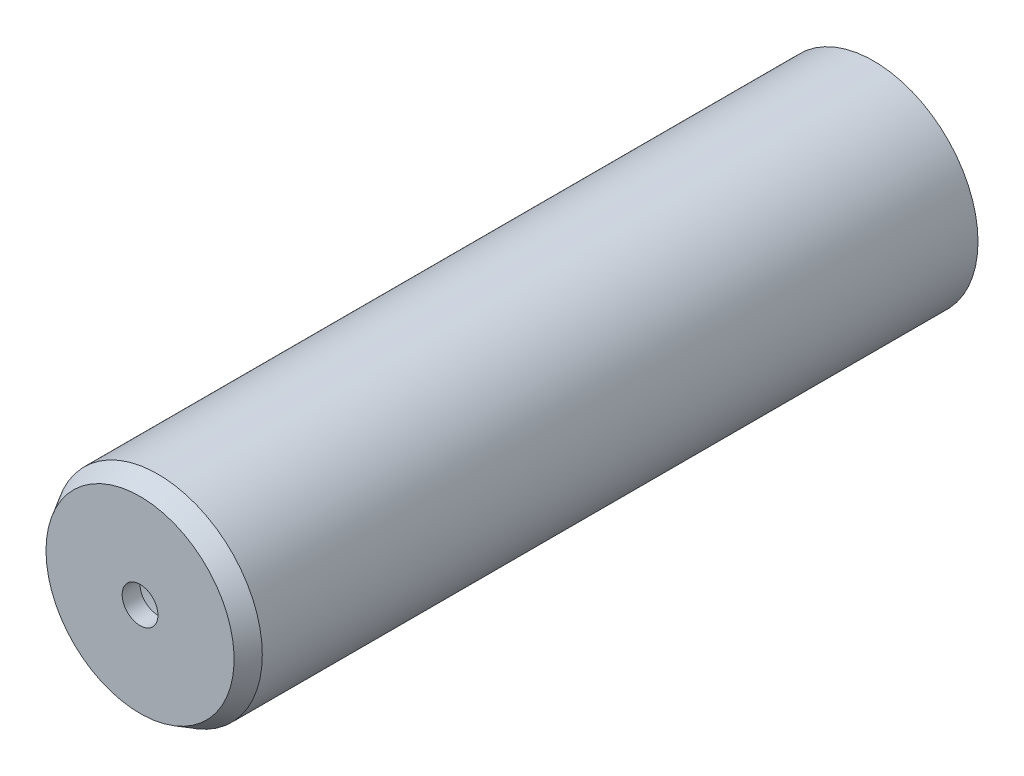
SolidWorks part; units mm, degrees
ref_plane "Спереди" through (0, 0, 0) normal (0, 0, 1) x (1, 0, 0)
ref_plane "Сверху" through (0, 0, 0) normal (0, 1, 0) x (1, 0, 0)
ref_plane "Справа" through (0, 0, 0) normal (1, 0, 0) x (0, 0, -1)
sketch "Эскиз2" plane through (0, 0, 0) normal (0, 0, 1) x (1, 0, 0)
  circle A0 centre (0, 0) radius 17.5
  circle A1 centre (0, 0) radius 15
  dimension "D1" = 35
  dimension "D2" = 30
extrude "Бобышка-Вытянуть1" add sketch "Эскиз2" along normal blind 120
sketch "Эскиз3" plane through (0, 0, 120) normal (0, 0, 1) x (1, 0, 0)
  circle A0 centre (0, 0) radius 17.5
  circle A1 centre (0, 0) radius 3
  dimension "D1" = 6
  dimension "D2" = 35
extrude "Бобышка-Вытянуть2" add sketch "Эскиз3" along normal blind 3
chamfer "Фаска1" distance 3 angle 30 1 edges at (17.5, 0, 123)
sketch "Эскиз5" plane through (0, 0, 0) normal (0, 0, -1) x (-1, 0, 0)
  line L0 (0, 0) -> (0, 15) construction
  line L1 (0, 0) -> (2.985, 14.7) construction
  line L2 (0, 15) -> (0, 10)
  line L3 (0, 10) -> (1.9502, 9.604)
  line L4 (1.9502, 9.604) -> (2.985, 14.7)
  circle A0 centre (0, 0) radius 15 construction
  arc A1 (0, 15) -> (2.985, 14.7) centre (0, 0) cw
  dimension "D2" = 5
  dimension "D1" = 3
extrude "Бобышка-Вытянуть3" add sketch "Эскиз5" against normal blind 20
chamfer "Фаска2" distance 5 angle 70 1 edges at (-0.9751, 9.802, 20)
sketch "Эскиз6" plane through (0, 0, 0) normal (0, 0, -1) x (-1, 0, 0)
  line L0 (0, 15) -> (0, 10)
  line L1 (0, 10) -> (1.9502, 9.604)
  line L2 (1.9502, 9.604) -> (2.985, 14.7)
  line L3 (-15, 0) -> (15, 0) construction
  arc A0 (0, 15) -> (2.985, 14.7) centre (0, 0) ccw construction
  arc A2 (2.985, 14.7) -> (0, 15) centre (0, 0) ccw
extrude "Вырез-Вытянуть1" cut sketch "Эскиз6" against normal blind 6
